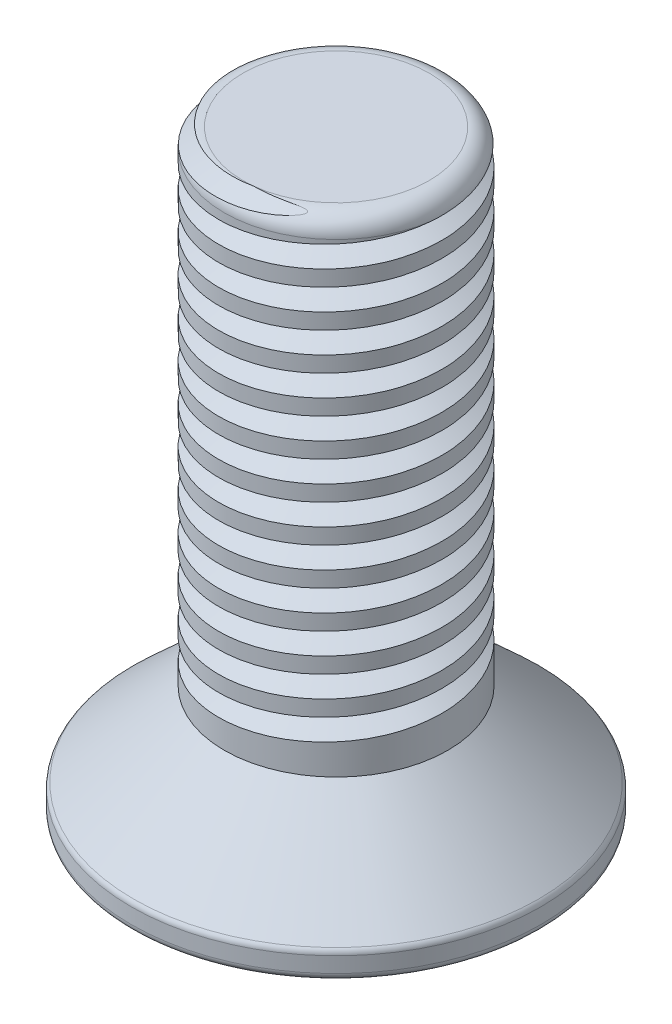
SolidWorks part; units mm, degrees
ref_plane "前视基准面" through (0, 0, 0) normal (0, 0, 1) x (1, 0, 0)
ref_plane "上视基准面" through (0, 0, 0) normal (0, 1, 0) x (1, 0, 0)
ref_plane "右视基准面" through (0, 0, 0) normal (1, 0, 0) x (0, 0, -1)
sketch "草图1" plane through (0, 0, 0) normal (0, 0, 1) x (1, 0, 0)
  line L0 (0, 3) -> (3, 3)
  line L1 (5.5, 0) -> (5.5, 0.7)
  line L2 (5.5, 0.7) -> (3, 3)
  line L3 (5.5, 0) -> (0, 0)
  line L4 (0, 0) -> (0, 3)
  dimension "D1" = 5.5
  dimension "D2" = 3
  dimension "D3" = 0.7
  dimension "D4" = 3
revolve "旋转1" add sketch "草图1" angle 360 about L4
fillet "圆角1" radius 0.2 2 edges at (0, 0, -5.5) (0, 0.7, -5.5)
sketch "草图2" plane through (0, 0, 0) normal (0, -1, 0) x (1, 0, 0)
  line L1 (2.3038, -0.1612) -> (1.2914, 1.9145)
  line L2 (1.2914, 1.9145) -> (-1.0123, 2.0757)
  line L3 (-1.0123, 2.0757) -> (-2.3038, 0.1612)
  line L4 (-2.3038, 0.1612) -> (-1.2914, -1.9145)
  line L5 (-1.2914, -1.9145) -> (1.0123, -2.0757)
  line L6 (1.0123, -2.0757) -> (2.3038, -0.1612)
  circle A0 centre (0, 0) radius 2 construction
  dimension "D1" = 4
extrude "切除-拉伸1" cut sketch "草图2" against normal blind 3
sketch "草图3" plane through (0, 3, 0) normal (0, 1, 0) x (1, 0, 0)
  circle A0 centre (0, 0) radius 3
extrude "凸台-拉伸1" add sketch "草图3" along normal blind 13
fillet "圆角2" radius 0.5 1 edges at (0, 16, 3)
sketch "草图4" plane through (0, 16, 0) normal (0, 1, 0) x (1, 0, 0)
  circle A0 centre (0, 0) radius 2.5
curve "螺旋线/涡状线1"
sketch "草图5" plane through (0, 0, 0) normal (0, 0, 1) x (1, 0, 0)
  line L1 (2.5, 13.924) -> (2.5, 34.6336) construction
  line L2 (2.5, 17.2332) -> (3.25, 16.8002)
  line L3 (3.25, 16.8002) -> (3.25, 17.6662)
  line L4 (3.25, 17.6662) -> (2.5, 17.2332)
  circle A0 centre (3, 17.2332) radius 0.25 construction
sweep "切除-扫描1" cut profiles "草图5" path "螺旋线/涡状线1"
